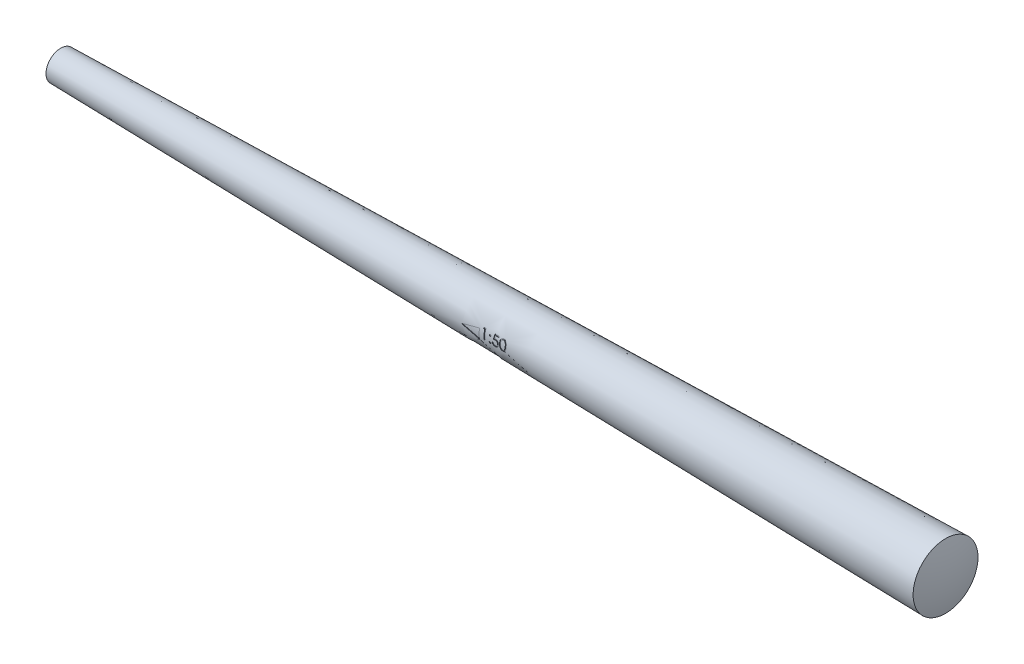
SolidWorks part; units mm, degrees
ref_plane "Front Plane" through (0, 0, 0) normal (0, 0, 1) x (1, 0, 0)
ref_plane "Top Plane" through (0, 0, 0) normal (0, 1, 0) x (1, 0, 0)
ref_plane "Right Plane" through (0, 0, 0) normal (1, 0, 0) x (0, 0, -1)
sketch "Sketch1" plane through (0, 0, 0) normal (1, 0, 0) x (0, 0, -1)
  circle A0 centre (0, 0) radius 1.5
  dimension "D1" = 3
extrude "Extrude1" add sketch "Sketch1" along normal mid plane 90
draft "Draft1" type of draft neutral plane draft angle 1.146 faces to draft 1 parameters "D1"=1.146
sketch "Sketch2" plane through (0, 0, 0) normal (0, 0, 1) x (1, 0, 0)
  line L0 (-45, 0) -> (-45, 1.5)
  line L1 (-45, 1.5) -> (-45, -1.5) construction
  line L2 (-45, 0) -> (-45.45, 0)
  line L3 (-45.45, 0) -> (-45.45, -2.4) construction
  line L4 (45, 0) -> (45, 3.3001)
  line L5 (45, -3.3001) -> (45, 3.3001) construction
  line L6 (45, 0) -> (45.45, 0)
  line L7 (45.45, 0) -> (45.45, -2.4) construction
  line L8 (-45, -1.5) -> (45, -3.3001) construction
  arc A0 (-45.45, 0) -> (-45, 1.5) centre (-42.725, 0) cw
  arc A1 (45.45, 0) -> (45, 3.3001) centre (33.1246, 0) ccw
  point P14 (0, -2.4)
revolve "Revolve1" add sketch "Sketch2" angle 360 about L2
sketch "Sketch5" plane through (0, 0, 0) normal (0, 0, 1) x (1, 0, 0)
  line L0 (0, 2.4) -> (0, -2.4) construction
  line L1 (45, 3.3001) -> (-45, 1.5) construction
  line L2 (-45, -1.5) -> (45, -3.3001) construction
ref_plane "Plane2" through (0, 0, 0) normal (-0.02, 0, 0.9998) x (0.9998, 0, 0.02)
sketch "Sketch6" plane through (0, 0, 0) normal (-0.02, 0, 0.9998) x (0.9998, 0, 0.02)
  line L0 (0, 0) -> (0, 0.5)
  line L1 (0, 2.4) -> (0, -2.4) construction
  line L2 (0, 0.5) -> (-1.866, 0)
  line L3 (-1.866, 0) -> (0, -0.5)
  line L4 (0, -0.5) -> (0, 0)
  line L5 (0, -0.25) -> (3, -0.25) construction
  text T0 "1:50" font "Century Gothic" height 1
  dimension "D1" = 1
  dimension "D2" = 30
  dimension "D3" = 3
wrap "Wrap2" sketch "Sketch6" wrap type deboss source sketch "Sketch6" thickness 0.05 parameters "D1"=0.05
equation "\"D2@Sketch2\" = \"D1@Sketch2\""
